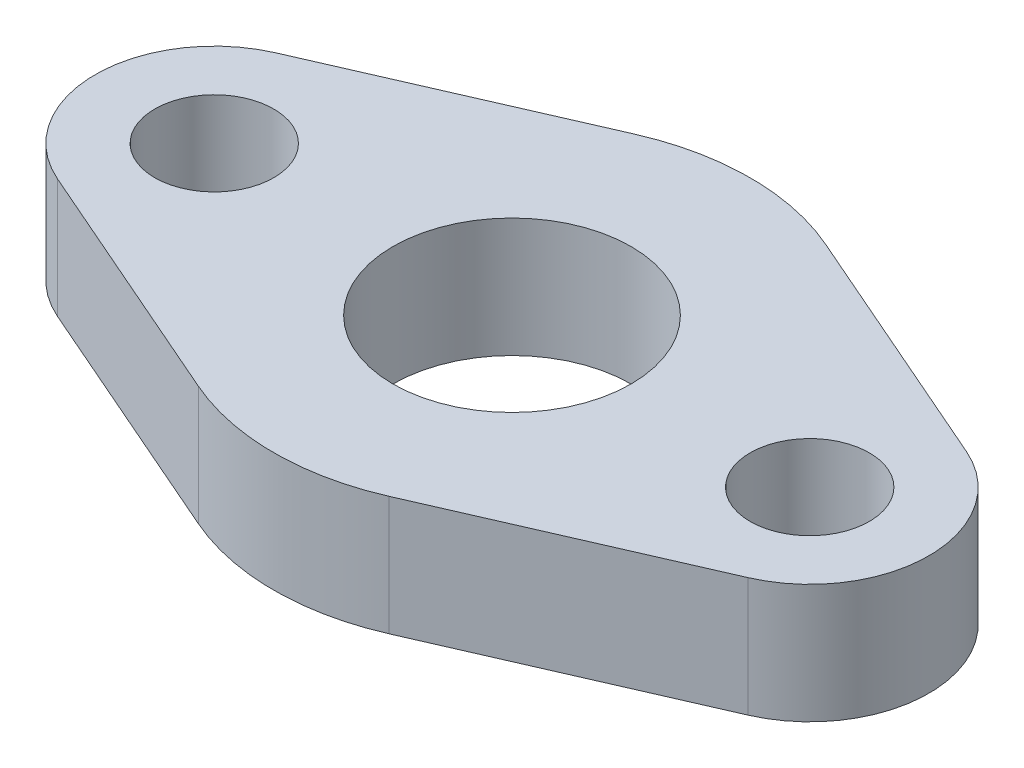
SolidWorks part; units mm, degrees
ref_plane "前视基准面" through (0, 0, 0) normal (0, 0, 1) x (1, 0, 0)
ref_plane "上视基准面" through (0, 0, 0) normal (0, 1, 0) x (1, 0, 0)
ref_plane "右视基准面" through (0, 0, 0) normal (1, 0, 0) x (0, 0, -1)
sketch "Sketch1" plane through (0, 0, 0) normal (0, 1, 0) x (1, 0, 0)
  line L0 (-103.9721, 0) -> (110.3951, 0) construction
  line L1 (0, -54.194) -> (0, 67.4414) construction
  line L2 (32, 73.3212) -> (116, 36.6606)
  line L3 (-32, 73.3212) -> (-116, 36.6606)
  line L4 (116, -36.6606) -> (32, -73.3212)
  line L5 (-32, -73.3212) -> (-116, -36.6606)
  circle A0 centre (0, 0) radius 40
  arc A1 (32, 73.3212) -> (-32, 73.3212) centre (0, 0) ccw
  arc A2 (116, -36.6606) -> (116, 36.6606) centre (100, 0) ccw
  circle A3 centre (100, 0) radius 20
  arc A4 (-116, 36.6606) -> (-116, -36.6606) centre (-100, 0) ccw
  circle A5 centre (-100, 0) radius 20
  arc A6 (-32, -73.3212) -> (32, -73.3212) centre (0, 0) ccw
  dimension "D1" = 160
  dimension "D2" = 80
  dimension "D3" = 80
  dimension "D5" = 80
  dimension "D6" = 40
  dimension "D7" = 40
  dimension "D4" = 200
extrude "Extrude1" add sketch "Sketch1" along normal blind 40
